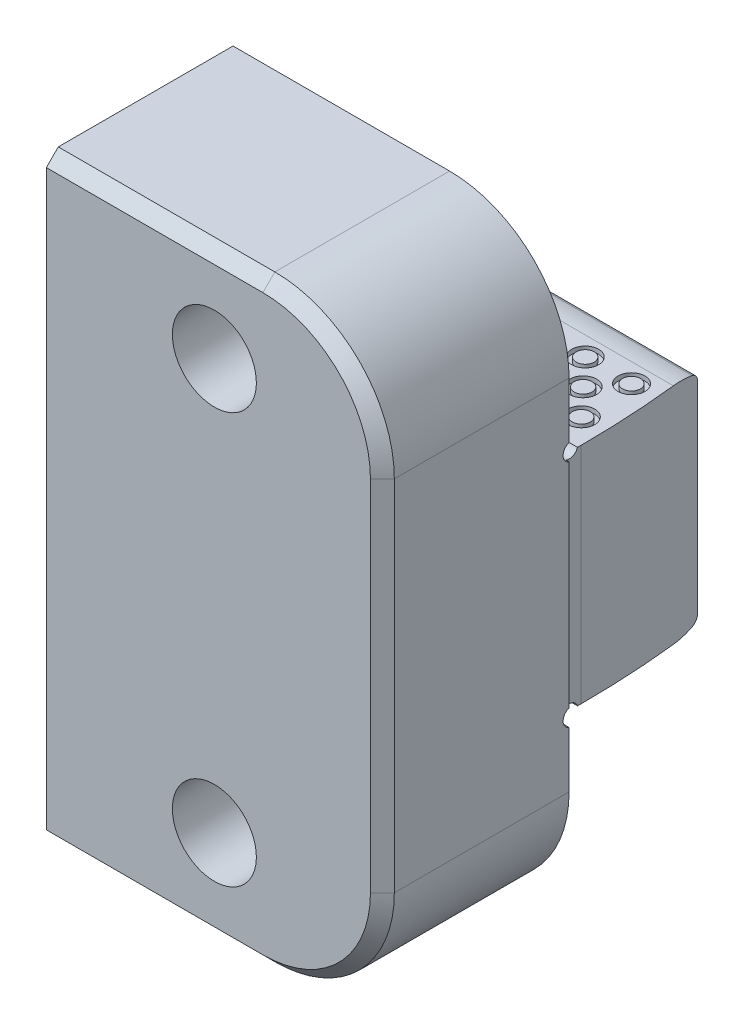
SolidWorks part; units mm, degrees
ref_plane "Front Plane" through (0, 0, 0) normal (0, 0, 1) x (1, 0, 0)
ref_plane "Top Plane" through (0, 0, 0) normal (0, 1, 0) x (1, 0, 0)
ref_plane "Right Plane" through (0, 0, 0) normal (1, 0, 0) x (0, 0, -1)
sketch "Sketch3" plane through (0, 0, 0) normal (1, 0, 0) x (0, 0, -1)
  line L0 (0, 15.7163) -> (0, -15.7163) construction
  line L1 (-15.875, -25.4) -> (0, -25.4)
  line L2 (-15.875, -25.4) -> (-15.875, 25.4)
  line L3 (-15.875, 25.4) -> (0, 25.4)
  line L4 (11.938, -9.5225) -> (11.938, 9.5225)
  line L6 (0, -25.4) -> (0, -9.5225)
  line L7 (0, -9.5225) -> (11.938, -9.5225)
  line L8 (0, 25.4) -> (0, 9.5225)
  line L9 (0, 9.5225) -> (11.938, 9.5225)
  line L10 (0, 0) -> (50000, 0) construction
  dimension "D1" = 27.813
  dimension "D2" = 15.875
  dimension "D3" = 50.8
  dimension "D4" = 19.0449
extrude "Extrude1" add sketch "Sketch3" along normal mid plane 28.575
sketch "Sketch7" plane through (14.2875, 0, 0) normal (1, 0, 0) x (0, 0, -1)
  line L1 (0, -14.5526) -> (21.9683, -14.5526)
  line L2 (0, -14.5526) -> (0, 17.1683)
  line L3 (0, 17.1683) -> (21.9683, 17.1683)
  line L4 (21.9683, -14.5526) -> (21.9683, 17.1683)
  line L5 (0, -25.4) -> (0, -9.5225) construction
extrude "Cut-Extrude3" cut sketch "Sketch7" against normal blind 0.254
sketch "Sketch8" plane through (14.2875, 0, 0) normal (1, 0, 0) x (0, 0, -1)
  line L0 (0, 0) -> (50000, 0) construction
  line L1 (0, -25.4) -> (0, 25.4) construction
  line L2 (0, 9.5225) -> (11.938, 9.5225) construction
  circle A0 centre (0.254, 9.7765) radius 0.762
  circle A1 centre (0.254, -9.7765) radius 0.762
  dimension "D1" = 0.762
  dimension "D2" = 0.508
  dimension "D3" = 0.508
extrude "Cut-Extrude4" cut sketch "Sketch8" against normal through all
sketch "Sketch9" plane through (14.2875, 0, 0) normal (1, 0, 0) x (0, 0, -1)
  line L0 (0.9724, 9.5225) -> (11.938, 9.5225) construction
  line L1 (11.938, 9.5225) -> (11.938, -9.5225) construction
  line L2 (0, 0) -> (50000, 0) construction
  line L3 (11.938, 8.5264) -> (15.9258, 8.5264)
  line L4 (9.5758, 9.5225) -> (9.5758, 14.8764)
  line L5 (9.5758, 14.8764) -> (15.9258, 14.8764)
  line L6 (15.9258, 8.5264) -> (15.9258, 14.8764)
  line L7 (15.9258, -8.5264) -> (15.9258, -14.8764)
  line L8 (9.5758, -14.8764) -> (15.9258, -14.8764)
  line L9 (9.5758, -9.5225) -> (9.5758, -14.8764)
  line L10 (11.938, -8.5264) -> (15.9258, -8.5264)
  arc A0 (9.5758, 9.5225) -> (11.3942, 9.2565) centre (9.5758, 3.1725) cw
  arc A1 (11.3942, 9.2565) -> (11.938, 8.5264) centre (11.176, 8.5264) cw
  arc A2 (11.3942, -9.2565) -> (11.938, -8.5264) centre (11.176, -8.5264) ccw
  arc A3 (9.5758, -9.5225) -> (11.3942, -9.2565) centre (9.5758, -3.1725) ccw
  dimension "D1" = 0.762
  dimension "D2" = 6.35
  dimension "D3" = 2.3622
  dimension "D4" = 6.35
  dimension "D5" = 6.35
extrude "Cut-Extrude5" cut sketch "Sketch9" against normal through all
sketch "Sketch13" plane through (0, 25.4, 0) normal (0, 1, 0) x (1, 0, 0)
  line L0 (14.0335, 0.9724) -> (14.0335, 9.5758) construction
  line L2 (9.6755, 26.67) -> (22.3755, 26.67)
  line L4 (14.0335, 1.27) -> (22.3755, 1.27)
  line L5 (22.3755, 26.67) -> (22.3755, 1.27)
  arc A0 (9.6755, 26.67) -> (14.0335, 1.27) centre (-62.1665, 1.27) cw
  dimension "D1" = 76.2
  dimension "D2" = 1.27
  dimension "D3" = 25.4
  dimension "D4" = 12.7
extrude "Cut-Extrude6" cut sketch "Sketch13" against normal through all
sketch "Sketch15" plane through (0, 9.5225, 0) normal (0, 1, 0) x (1, 0, 0)
  line L0 (14.2875, -15.875) -> (-14.2875, -15.875) construction
  line L1 (-14.2875, 9.5758) -> (-14.2875, 0.9724) construction
  line L2 (-14.2875, 0) -> (-14.2875, -15.875) construction
  circle A0 centre (-8.0391, 7.9502) radius 1.143
  circle A1 centre (-8.0391, 7.9502) radius 0.762
  circle A2 centre (-4.1021, 7.9502) radius 1.143
  circle A3 centre (-4.1021, 7.9502) radius 0.762
  circle A4 centre (-11.9761, 7.9502) radius 1.143
  circle A5 centre (-11.9761, 7.9502) radius 0.762
  circle A6 centre (-0.1651, 7.9502) radius 1.143
  circle A7 centre (-0.1651, 7.9502) radius 0.762
  circle A8 centre (3.7719, 7.9502) radius 1.143
  circle A9 centre (3.7719, 7.9502) radius 0.762
  circle A10 centre (11.6459, 7.9502) radius 1.143
  circle A11 centre (11.6459, 7.9502) radius 0.762
  circle A12 centre (7.7089, 7.9502) radius 1.143
  circle A13 centre (7.7089, 7.9502) radius 0.762
  circle A14 centre (-6.0325, 5.6642) radius 1.143
  circle A15 centre (-6.0325, 5.6642) radius 0.762
  circle A16 centre (-2.0701, 5.6642) radius 1.143
  circle A17 centre (-2.0701, 5.6642) radius 0.762
  circle A18 centre (-9.9949, 5.6642) radius 1.143
  circle A19 centre (-9.9949, 5.6642) radius 0.762
  circle A20 centre (1.8923, 5.6642) radius 1.143
  circle A21 centre (1.8923, 5.6642) radius 0.762
  circle A22 centre (5.8547, 5.6642) radius 1.143
  circle A23 centre (5.8547, 5.6642) radius 0.762
  circle A26 centre (9.8171, 5.6642) radius 1.143
  circle A27 centre (9.8171, 5.6642) radius 0.762
  circle A28 centre (-7.9883, 3.3782) radius 1.143
  circle A29 centre (-7.9883, 3.3782) radius 0.762
  circle A30 centre (-4.0005, 3.3782) radius 1.143
  circle A31 centre (-4.0005, 3.3782) radius 0.762
  circle A32 centre (-11.9761, 3.3782) radius 1.143
  circle A33 centre (-11.9761, 3.3782) radius 0.762
  circle A34 centre (-0.0127, 3.3782) radius 1.143
  circle A35 centre (-0.0127, 3.3782) radius 0.762
  circle A36 centre (3.9751, 3.3782) radius 1.143
  circle A37 centre (3.9751, 3.3782) radius 0.762
  circle A38 centre (11.9507, 3.3782) radius 1.143
  circle A39 centre (11.9507, 3.3782) radius 0.762
  circle A40 centre (7.9629, 3.3782) radius 1.143
  circle A41 centre (7.9629, 3.3782) radius 0.762
  dimension "D1" = 23.8252
  dimension "D2" = 2.286
  dimension "D12" = 3.937
  dimension "D7" = 2.286
  dimension "D8" = 1.524
  dimension "D3" = 2.286
  dimension "D4" = 2.3114
  dimension "D5" = 4.2926
  dimension "D6" = 3.937
  dimension "D9" = 3.937
  dimension "D10" = 3.937
  dimension "D11" = 3.937
  dimension "D13" = 3.937
  dimension "D14" = 3.9624
  dimension "D15" = 3.9624
  dimension "D16" = 3.9624
  dimension "D17" = 3.9624
  dimension "D18" = 3.9624
  dimension "D19" = 3.9878
  dimension "D20" = 3.9878
  dimension "D21" = 3.9878
  dimension "D22" = 3.9878
  dimension "D23" = 3.9878
  dimension "D24" = 3.9878
extrude "Cut-Extrude7" cut sketch "Sketch15" against normal blind 0.381
mirror "Mirror1" about plane through (0, 0, 0) normal (0, 1, 0) of "Cut-Extrude7"
hole_wizard "1/4\"-20 CBORE" positions "Sketch11" profile "Sketch10" counterbore size "1/4" standard "Ansi Inch"
sketch "Sketch11" plane through (0, 0, 0) normal (0, 0, -1) x (-1, 0, 0)
  line L0 (0, 0) -> (0, 50000) construction
  line L1 (0, 0) -> (50000, 0) construction
  point P0 (0, 17.4625)
  point P10 (0, -17.4625)
  dimension "D1" = 34.925
sketch "Sketch10" plane through (0, 17.4625, 0) normal (1, 0, 0) x (0, 1, 0)
  line L0 (0, 0) -> (0, 15.875)
  line L1 (0, 15.875) -> (3.5712, 15.875)
  line L3 (3.5712, 15.875) -> (3.5712, 7.145)
  line L4 (3.5712, 7.145) -> (5.5562, 7.145)
  line L5 (5.5562, 7.145) -> (5.5562, 0)
  line L7 (5.5562, 0) -> (0, 0)
  line L11 (0, -6.35) -> (0, 107.95) construction
  dimension "Thru Hole Dia." = 7.1425
  dimension "Thru Hole Depth" = 15.875
  dimension "C'Bore Dia." = 11.1125
  dimension "C'Bore Depth" = 7.145
fillet "Fillet1" radius 10.16 2 edges at (14.2875, -25.4, 7.9375) (14.2875, 25.4, 7.9375)
chamfer "Chamfer1" distance 1.016 angle 45 5 edges at (-5.08, 25.4, 15.875) (-5.08, -25.4, 15.875) (14.2875, 0, 15.875) (11.3117, 22.4242, 15.875) (11.3117, -22.4242, 15.875)
